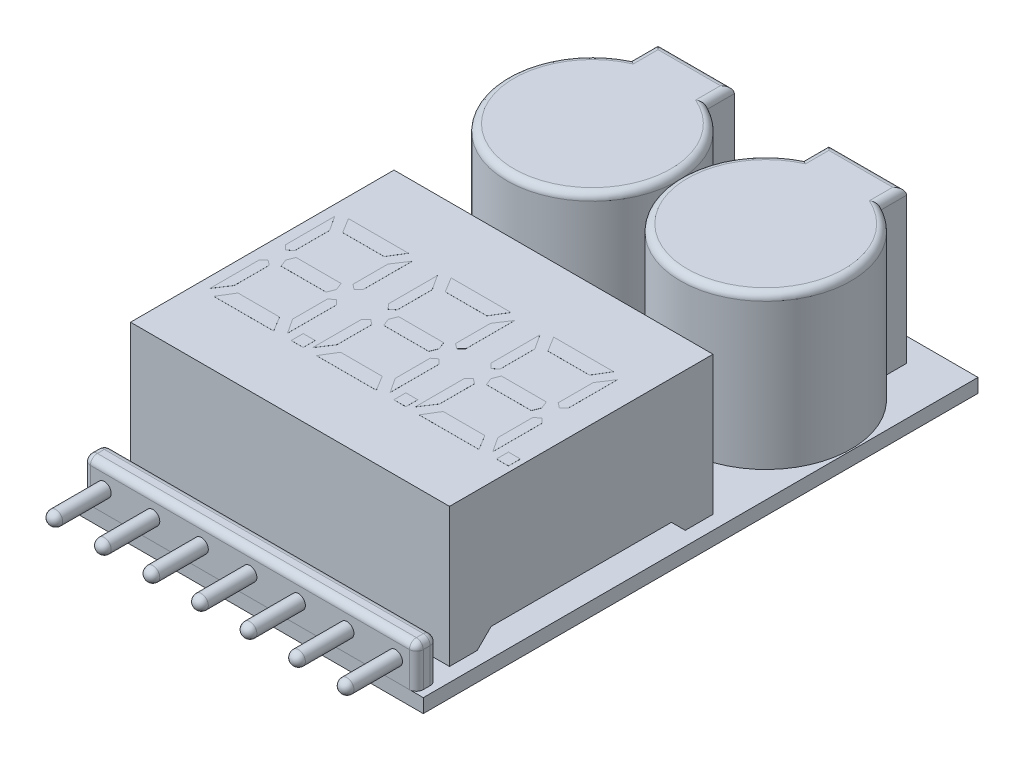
SolidWorks part; units mm, degrees
ref_plane "Ön Düzlem" through (0, 0, 0) normal (0, 0, 1) x (1, 0, 0)
ref_plane "Üst Düzlem" through (0, 0, 0) normal (0, 1, 0) x (1, 0, 0)
ref_plane "Sağ Düzlem" through (0, 0, 0) normal (1, 0, 0) x (0, 0, -1)
sketch "Çizim1" plane through (0, 0, 0) normal (0, 1, 0) x (1, 0, 0)
  line L1 (12.5, -20) -> (-12.5, -20)
  line L2 (12.5, -20) -> (12.5, 20)
  line L3 (12.5, 20) -> (-12.5, 20)
  line L4 (-12.5, -20) -> (-12.5, 20)
  line L5 (12.5, -20) -> (-12.5, 20) construction
  line L6 (12.5, 20) -> (-12.5, -20) construction
  point P0 (0, 0)
  dimension "D1" = 40
  dimension "D2" = 25
extrude "Yükseklik-Ekstrüzyon1" add sketch "Çizim1" along normal blind 1
sketch "Çizim2" plane through (0, 1, 0) normal (0, 1, 0) x (1, 0, 0)
  line L0 (-12.5, -20) -> (12.5, -20) construction
  line L1 (-12, -20) -> (12, -20)
  line L2 (-12, -20) -> (-12, -18.5)
  line L3 (-12, -18.5) -> (12, -18.5)
  line L4 (12, -20) -> (12, -18.5)
  line L5 (-12.5, 20) -> (-12.5, -20) construction
  line L6 (12.5, -20) -> (12.5, 20) construction
  dimension "D1" = 0.5
  dimension "D2" = 0.5
  dimension "D3" = 1.5
extrude "Yükseklik-Ekstrüzyon2" add sketch "Çizim2" along normal blind 3 separate body
sketch "Çizim3" plane through (0, 0, 20) normal (0, 0, 1) x (1, 0, 0)
  line L0 (-12, 2.5) -> (12, 2.5) construction
  line L1 (-12, 4) -> (-12, 1) construction
  line L2 (12, 4) -> (12, 1) construction
  line L3 (-8.5, 2.5) -> (15.5, 2.5) construction
  line L4 (-5, 2.5) -> (19, 2.5) construction
  line L5 (-1.5, 2.5) -> (22.5, 2.5) construction
  line L6 (-15.5, 2.5) -> (8.5, 2.5) construction
  line L7 (-19, 2.5) -> (5, 2.5) construction
  line L8 (-22.5, 2.5) -> (1.5, 2.5) construction
  circle A0 centre (0, 2.5) radius 0.5
  circle A1 centre (3.5, 2.5) radius 0.5
  circle A2 centre (7, 2.5) radius 0.5
  circle A3 centre (10.5, 2.5) radius 0.5
  circle A4 centre (-3.5, 2.5) radius 0.5
  circle A5 centre (-7, 2.5) radius 0.5
  circle A6 centre (-10.5, 2.5) radius 0.5
  dimension "D1" = 1
  dimension "D2" = 4
  dimension "D3" = 4
extrude "Yükseklik-Ekstrüzyon3" add sketch "Çizim3" along normal blind 4
sketch "Çizim4" plane through (0, 1, 0) normal (0, 1, 0) x (1, 0, 0)
  line L1 (-11.5, -17.1093) -> (11.5, -17.1093)
  line L2 (-11.5, -17.1093) -> (-11.5, 1.8907)
  line L3 (-11.5, 1.8907) -> (11.5, 1.8907)
  line L4 (11.5, -17.1093) -> (11.5, 1.8907)
  line L5 (-11.5, -17.1093) -> (11.5, 1.8907) construction
  line L6 (-11.5, 1.8907) -> (11.5, -17.1093) construction
  point P0 (0, -7.6093)
  dimension "D1" = 19
  dimension "D2" = 23
extrude "Yükseklik-Ekstrüzyon4" add sketch "Çizim4" along normal blind 10
sketch "Çizim5" plane through (0, 1, 0) normal (0, 1, 0) x (1, 0, 0)
  line L7 (3.4483, 16.4277) -> (3.4483, 18.2977)
  line L9 (-9, 16.4539) -> (-9, 18.4278)
  line L10 (-9, 18.4278) -> (-3.5, 18.4278)
  line L11 (-3.5, 16.4539) -> (-3.5, 18.4278)
  line L14 (9.0517, 18.2977) -> (3.4483, 18.2977)
  line L15 (9.0517, 16.4277) -> (9.0517, 18.2977)
  arc A0 (-9, 16.4539) -> (-3.5, 16.4539) centre (-6.25, 10.9454) ccw
  arc A1 (3.4483, 16.4277) -> (9.0517, 16.4277) centre (6.25, 10.9454) ccw
  point P9 (0, 6.418)
  point P16 (-6.25, 17.1022)
  dimension "D1" = 5.5
extrude "Yükseklik-Ekstrüzyon10" add sketch "Çizim5" along normal blind 11
sketch "Çizim6" plane through (-11.5, 0, 0) normal (-1, 0, 0) x (0, 0, 1)
  line L0 (15.1093, 1) -> (14.1093, 2)
  line L1 (-1.8907, 1) -> (17.1093, 1) construction
  line L2 (14.1093, 2) -> (1.1093, 2)
  line L3 (1.1093, 2) -> (0.1093, 1)
  line L4 (15.1093, 1) -> (0.1093, 1)
  point P4 (7.6093, 1)
  point P7 (7.6093, 2)
  dimension "D1" = 2
  dimension "D2" = 1
  dimension "D3" = 135
extrude "Kes-Ekstrüzyon2" cut sketch "Çizim6" against normal blind 40
sketch "Çizim7" plane through (0, 0, 17.1093) normal (0, 0, 1) x (1, 0, 0)
  line L0 (-9.5, 1) -> (-8.386, 2)
  line L2 (-12.5, 1) -> (12.5, 1) construction
  line L3 (-8.386, 2) -> (8.386, 2)
  line L4 (11.5, 11) -> (11.5, 1) construction
  line L5 (-11.5, 11) -> (-11.5, 1) construction
  line L6 (-11.5, 6) -> (11.5, 6) construction
  line L8 (8.386, 2) -> (9.2837, 1)
  line L9 (-11.5, 1) -> (11.5, 1) construction
  line L10 (-9.5, 1) -> (9.2837, 1)
  line L14 (0, 6) -> (0, 11) construction
  line L15 (-11.5, 11) -> (11.5, 11) construction
  point P5 (0, 2)
  dimension "D1" = 23
  dimension "D2" = 2
  dimension "D3" = 1
extrude "Kes-Ekstrüzyon3" cut sketch "Çizim7" against normal blind 20
fillet "Radyus1" radius 0.5 8 edges at (12, 4, 19.25) (0, 4, 20) (12, 2.5, 20) (-12, 4, 19.25) (-12, 2.5, 20) (-12, 2.5, 18.5) (0, 4, 18.5) (12, 2.5, 18.5)
fillet "Radyus2" radius 0.5 8 edges at (3.4483, 12, -17.3627) (6.25, 12, -18.2977) (9.0517, 12, -17.3627) (6.25, 12, -4.7885) (-9, 12, -17.4408) (-6.25, 12, -18.4278) (-3.5, 12, -17.4408) (-6.25, 12, -4.7885)
sketch "Çizim8" plane through (0, 11, 0) normal (0, 1, 0) x (1, 0, 0)
  line L0 (-9.5659, -7.1026) -> (-6.3259, -7.1026)
  line L1 (-6.4462, -11.4175) -> (-9.4456, -11.4175)
  line L2 (-9.4456, -11.4175) -> (-10.1059, -12.4975)
  line L3 (-10.048, -11.0796) -> (-10.743, -12.1376)
  line L4 (-10.743, -12.1376) -> (-10.743, -8.6075)
  line L5 (-10.048, -11.0796) -> (-10.048, -8.5587)
  line L6 (-10.743, -8.6075) -> (-10.4177, -8.2746)
  line L7 (-10.4177, -8.2746) -> (-10.048, -8.5587)
  line L8 (-9.5659, -8.1826) -> (-6.3259, -8.1826)
  line L9 (-10.1059, -12.4975) -> (-5.7859, -12.4975)
  line L10 (-4.559, -11.5993) -> (-3.695, -11.5993)
  line L11 (-4.559, -11.5993) -> (-4.559, -12.4633)
  line L12 (-4.559, -12.4633) -> (-3.695, -12.4633)
  line L13 (-9.7799, -7.6426) -> (-9.5659, -7.1026)
  line L14 (-3.695, -11.5993) -> (-3.695, -12.4633)
  line L15 (-6.112, -7.6426) -> (-6.3259, -7.1026)
  line L16 (-5.4741, -8.2746) -> (-5.8439, -8.5587)
  line L17 (-5.1489, -8.6075) -> (-5.4741, -8.2746)
  line L18 (-5.8439, -11.0796) -> (-5.8439, -8.5587)
  line L19 (-5.1489, -12.1376) -> (-5.1489, -8.6075)
  line L20 (-5.8439, -11.0796) -> (-5.1489, -12.1376)
  line L21 (-6.4462, -11.4175) -> (-5.7859, -12.4975)
  line L23 (-2.7059, -12.4975) -> (1.6141, -12.4975)
  line L24 (-5.7859, -2.7878) -> (-10.1059, -2.7878)
  line L25 (4.6941, -12.4975) -> (9.0141, -12.4975)
  line L26 (-9.4456, -3.8678) -> (-6.4462, -3.8678)
  line L27 (-6.4462, -3.8678) -> (-5.7859, -2.7878)
  line L28 (-5.8439, -4.2057) -> (-5.1489, -3.1477)
  line L29 (-5.1489, -3.1477) -> (-5.1489, -6.6778)
  line L30 (-5.8439, -4.2057) -> (-5.8439, -6.7266)
  line L31 (-5.1489, -6.6778) -> (-5.4741, -7.0107)
  line L32 (-5.4741, -7.0107) -> (-5.8439, -6.7266)
  line L33 (0.9538, -11.4175) -> (-2.0456, -11.4175)
  line L34 (-6.112, -7.6426) -> (-6.3259, -8.1826)
  line L35 (-9.7799, -7.6426) -> (-9.5659, -8.1826)
  line L36 (-2.0456, -11.4175) -> (-2.7059, -12.4975)
  line L37 (5.2341, -8.1826) -> (8.4741, -8.1826)
  line L38 (8.4741, -7.1026) -> (5.2341, -7.1026)
  line L39 (-10.4177, -7.0107) -> (-10.048, -6.7266)
  line L40 (-10.743, -6.6778) -> (-10.4177, -7.0107)
  line L41 (-10.048, -4.2057) -> (-10.048, -6.7266)
  line L42 (-10.743, -3.1477) -> (-10.743, -6.6778)
  line L43 (-10.048, -4.2057) -> (-10.743, -3.1477)
  line L44 (-9.4456, -3.8678) -> (-10.1059, -2.7878)
  line L46 (-2.648, -11.0796) -> (-3.343, -12.1376)
  line L48 (-3.343, -12.1376) -> (-3.343, -8.6075)
  line L49 (-2.648, -11.0796) -> (-2.648, -8.5587)
  line L50 (-3.343, -8.6075) -> (-3.0177, -8.2746)
  line L51 (-3.0177, -8.2746) -> (-2.648, -8.5587)
  line L52 (1.0741, -8.1826) -> (-2.1659, -8.1826)
  line L53 (-2.1659, -7.1026) -> (1.0741, -7.1026)
  line L54 (2.841, -11.5993) -> (3.705, -11.5993)
  line L55 (2.841, -11.5993) -> (2.841, -12.4633)
  line L56 (2.841, -12.4633) -> (3.705, -12.4633)
  line L57 (-2.3799, -7.6426) -> (-2.1659, -7.1026)
  line L58 (3.705, -11.5993) -> (3.705, -12.4633)
  line L59 (1.288, -7.6426) -> (1.0741, -7.1026)
  line L60 (1.9259, -8.2746) -> (1.5561, -8.5587)
  line L61 (2.2511, -8.6075) -> (1.9259, -8.2746)
  line L62 (1.5561, -11.0796) -> (1.5561, -8.5587)
  line L63 (2.2511, -12.1376) -> (2.2511, -8.6075)
  line L64 (1.5561, -11.0796) -> (2.2511, -12.1376)
  line L65 (0.9538, -11.4175) -> (1.6141, -12.4975)
  line L68 (1.6141, -2.7878) -> (-2.7059, -2.7878)
  line L69 (-2.0456, -3.8678) -> (0.9538, -3.8678)
  line L70 (0.9538, -3.8678) -> (1.6141, -2.7878)
  line L71 (1.5561, -4.2057) -> (2.2511, -3.1477)
  line L72 (2.2511, -3.1477) -> (2.2511, -6.6778)
  line L73 (1.5561, -4.2057) -> (1.5561, -6.7266)
  line L74 (2.2511, -6.6778) -> (1.9259, -7.0107)
  line L75 (1.9259, -7.0107) -> (1.5561, -6.7266)
  line L76 (1.288, -7.6426) -> (1.0741, -8.1826)
  line L77 (-2.3799, -7.6426) -> (-2.1659, -8.1826)
  line L80 (-3.0177, -7.0107) -> (-2.648, -6.7266)
  line L81 (-3.343, -6.6778) -> (-3.0177, -7.0107)
  line L82 (-2.648, -4.2057) -> (-2.648, -6.7266)
  line L83 (-3.343, -3.1477) -> (-3.343, -6.6778)
  line L84 (-2.648, -4.2057) -> (-3.343, -3.1477)
  line L85 (-2.0456, -3.8678) -> (-2.7059, -2.7878)
  line L88 (-11.5, 1.8907) -> (11.5, 1.8907) construction
  line L94 (8.3538, -11.4175) -> (5.3544, -11.4175)
  line L95 (5.3544, -11.4175) -> (4.6941, -12.4975)
  line L96 (4.752, -11.0796) -> (4.057, -12.1376)
  line L97 (4.057, -12.1376) -> (4.057, -8.6075)
  line L98 (4.752, -11.0796) -> (4.752, -8.5587)
  line L99 (4.057, -8.6075) -> (4.3823, -8.2746)
  line L100 (4.3823, -8.2746) -> (4.752, -8.5587)
  line L103 (10.241, -11.5993) -> (11.105, -11.5993)
  line L104 (10.241, -11.5993) -> (10.241, -12.4633)
  line L105 (10.241, -12.4633) -> (11.105, -12.4633)
  line L106 (5.0201, -7.6426) -> (5.2341, -7.1026)
  line L107 (11.105, -11.5993) -> (11.105, -12.4633)
  line L108 (8.688, -7.6426) -> (8.4741, -7.1026)
  line L109 (9.3259, -8.2746) -> (8.9561, -8.5587)
  line L110 (9.6511, -8.6075) -> (9.3259, -8.2746)
  line L111 (8.9561, -11.0796) -> (8.9561, -8.5587)
  line L112 (9.6511, -12.1376) -> (9.6511, -8.6075)
  line L113 (8.9561, -11.0796) -> (9.6511, -12.1376)
  line L114 (8.3538, -11.4175) -> (9.0141, -12.4975)
  line L117 (9.0141, -2.7878) -> (4.6941, -2.7878)
  line L118 (5.3544, -3.8678) -> (8.3538, -3.8678)
  line L119 (8.3538, -3.8678) -> (9.0141, -2.7878)
  line L120 (8.9561, -4.2057) -> (9.6511, -3.1477)
  line L121 (9.6511, -3.1477) -> (9.6511, -6.6778)
  line L122 (8.9561, -4.2057) -> (8.9561, -6.7266)
  line L123 (9.6511, -6.6778) -> (9.3259, -7.0107)
  line L124 (9.3259, -7.0107) -> (8.9561, -6.7266)
  line L125 (8.688, -7.6426) -> (8.4741, -8.1826)
  line L126 (5.0201, -7.6426) -> (5.2341, -8.1826)
  line L129 (4.3823, -7.0107) -> (4.752, -6.7266)
  line L130 (4.057, -6.6778) -> (4.3823, -7.0107)
  line L131 (4.752, -4.2057) -> (4.752, -6.7266)
  line L132 (4.057, -3.1477) -> (4.057, -6.6778)
  line L133 (4.752, -4.2057) -> (4.057, -3.1477)
  line L134 (5.3544, -3.8678) -> (4.6941, -2.7878)
  point P5 (6.7908, -7.6093)
  point P55 (-7.9459, -7.6093)
  point P80 (-0.5459, -7.6093)
  point P138 (6.8541, -7.6093)
  point P156 (15.105, -7.6093)
extrude "Yükseklik-Ekstrüzyon11" add sketch "Çizim8" along normal blind 0.005 separate body
fillet "Radyus3" radius 0.5 7 edges at (7.5, 2.5, 24) (4, 2.5, 24) (0.5, 2.5, 24) (-3, 2.5, 24) (-6.5, 2.5, 24) (-10, 2.5, 24) (11, 2.5, 24)
